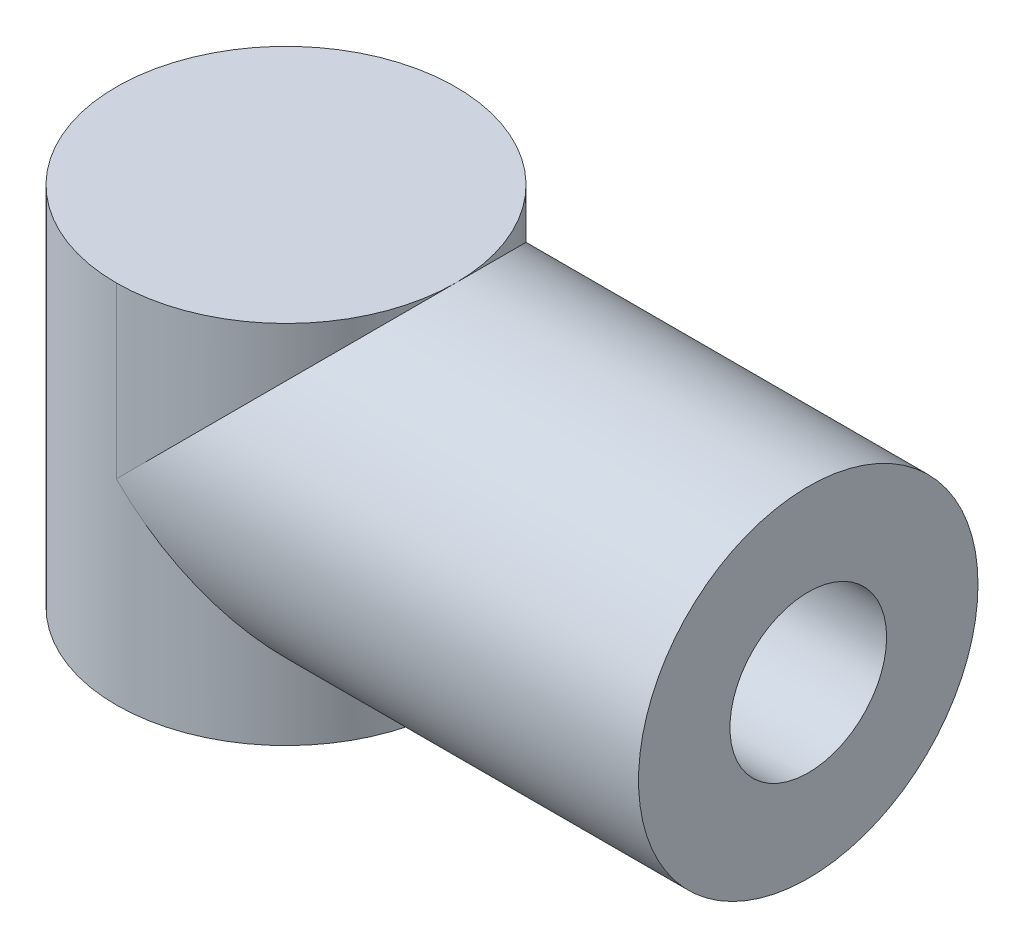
SolidWorks part; units mm, degrees
ref_plane "Plan de face" through (0, 0, 0) normal (0, 0, 1) x (1, 0, 0)
ref_plane "Plan de dessus" through (0, 0, 0) normal (0, 1, 0) x (1, 0, 0)
ref_plane "Plan de droite" through (0, 0, 0) normal (1, 0, 0) x (0, 0, -1)
sketch "Esquisse1" plane through (0, 0, 0) normal (0, 0, 1) x (1, 0, 0)
  line L0 (0, 74.8842) -> (0, -27.898) construction
  line L1 (0, 7) -> (3.25, 7)
  line L2 (3.25, 7) -> (3.25, 0)
  line L3 (3.25, 0) -> (0, 0)
  line L6 (0, 0) -> (0, 7)
  dimension "D1" = 6.5
  dimension "D3" = 7
revolve "Révolution1" add sketch "Esquisse1" angle 360 about L0
sketch "Esquisse2" plane through (0, 0, 0) normal (1, 0, 0) x (0, 0, -1)
  line L1 (3.25, 0) -> (3.25, 7) construction
  line L2 (0, -0.6788) -> (0, 7.5579) construction
  line L3 (3.25, 7) -> (-3.25, 7) construction
  circle A0 centre (0, 3.75) radius 3.25
extrude "Extrusion1" add sketch "Esquisse2" along normal blind 10
sketch "Esquisse4" plane through (0, 0, 0) normal (0, -1, 0) x (1, 0, 0)
  circle A0 centre (0, 0) radius 1.5
  dimension "D1" = 3
extrude "Enlèv. mat.-Extru.2" cut sketch "Esquisse4" against normal blind 5.5
sketch "Esquisse3" plane through (10, 0, 0) normal (1, 0, 0) x (0, 0, -1)
  circle A0 centre (0, 3.75) radius 1.5
  circle A1 centre (0, 3.75) radius 3.25 construction
  dimension "D1" = 3
extrude "Enlèv. mat.-Extru.1" cut sketch "Esquisse3" against normal up to surface (10 mm away)
